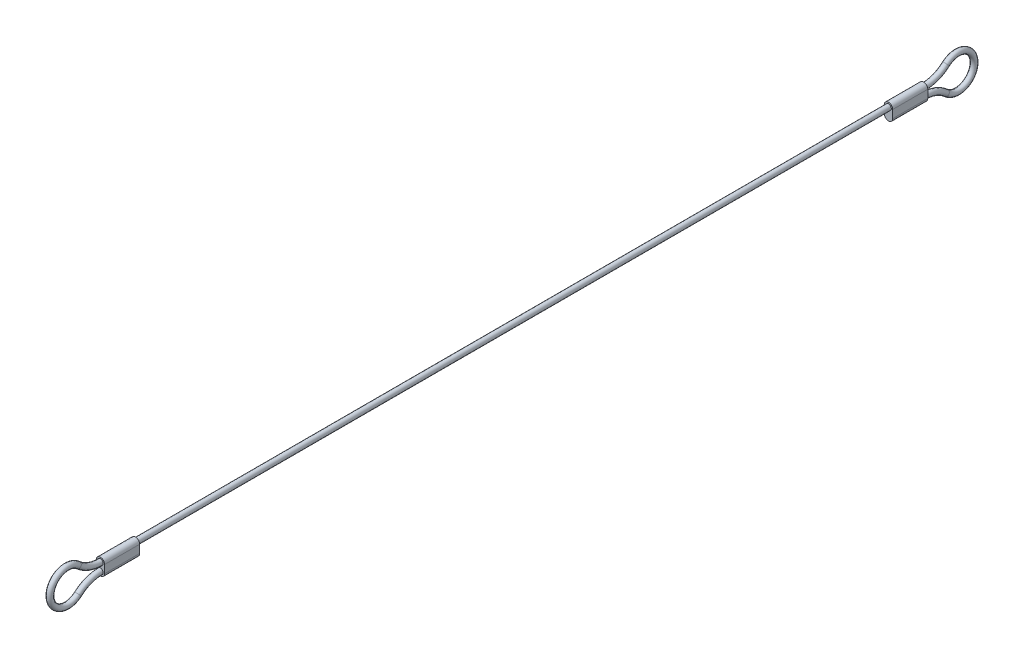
SolidWorks part; units mm, degrees
ref_plane "Front Plane" through (0, 0, 0) normal (0, 0, 1) x (1, 0, 0)
ref_plane "Top Plane" through (0, 0, 0) normal (0, 1, 0) x (1, 0, 0)
ref_plane "Right Plane" through (0, 0, 0) normal (1, 0, 0) x (0, 0, -1)
sketch "Sketch1" plane through (0, 0, 0) normal (1, 0, 0) x (0, 0, -1)
  line L0 (117.4, 0) -> (-117.4, 0)
  line L1 (0, 1.32) -> (0, -1.32) construction
  arc A0 (-117.4, 0) -> (-123.8, 2.4446) centre (-117.4, 9.6) cw
  arc A1 (-123.8, 2.4446) -> (-123.8, -4.7108) centre (-127, -1.1331) ccw
  arc A2 (-123.8, -4.7108) -> (-117.4, -2.2663) centre (-117.4, -11.8663) cw
  arc A3 (123.8, -4.7108) -> (117.4, -2.2663) centre (117.4, -11.8663) ccw
  arc A4 (123.8, 2.4446) -> (123.8, -4.7108) centre (127, -1.1331) cw
  arc A5 (117.4, 0) -> (123.8, 2.4446) centre (117.4, 9.6) ccw
  point P18 (0, 0)
  dimension "D1" = 4.8
  dimension "D4" = 9.6
  dimension "D2" = 127
  dimension "D3" = 9.6
sketch "Sketch2" plane through (0, 0, 0) normal (0, 0, 1) x (1, 0, 0)
  circle A0 centre (0, 0) radius 0.795
  dimension "D1" = 1.59
sweep "Sweep1" add profiles "Sketch2" path "Sketch1"
sketch "Sketch3" plane through (0, 0, 117.4) normal (0, 0, -1) x (-1, 0, 0)
  line L0 (0, 0) -> (0, -2.2663) construction
  line L1 (1.2, 0) -> (1.2, -2.2663)
  line L2 (-1.2, 0) -> (-1.2, -2.2663)
  line L3 (-0.795, -2.2663) -> (0.795, -2.2663) construction
  arc A0 (1.2, 0) -> (-1.2, 0) centre (0, 0) ccw
  arc A1 (-1.2, -2.2663) -> (1.2, -2.2663) centre (0, -2.2663) ccw
  point P3 (0, -1.1331)
  dimension "D1" = 2.4
extrude "Boss-Extrude1" add sketch "Sketch3" along normal blind 10
mirror "Mirror1" about plane through (0, 0, 0) normal (0, 0, 1) of "Boss-Extrude1"
